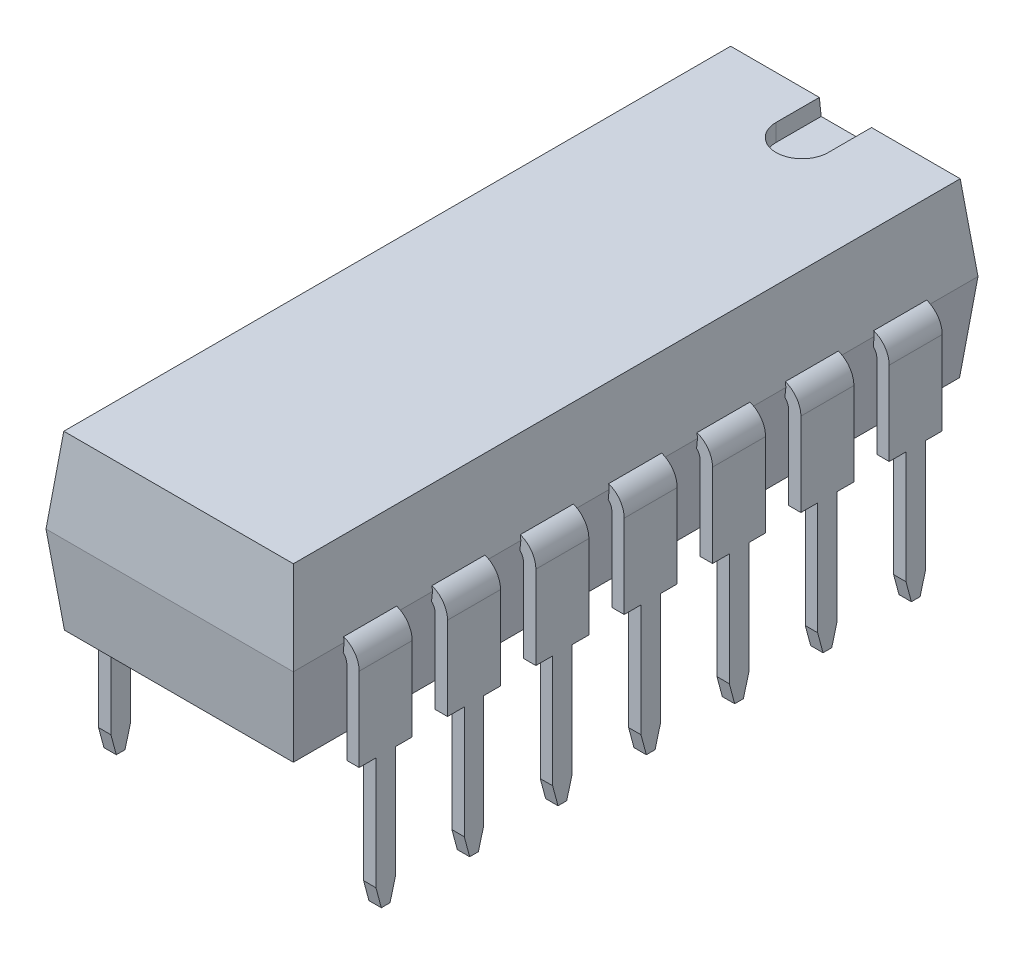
SolidWorks part; units mm, degrees
ref_plane "Front" through (0, 0, 0) normal (0, 0, 1) x (1, 0, 0)
ref_plane "Top" through (0, 0, 0) normal (0, 1, 0) x (1, 0, 0)
ref_plane "Right" through (0, 0, 0) normal (1, 0, 0) x (0, 0, -1)
ref_plane "Pin1" through (0, 0, -7.62) normal (0, 0, 1) x (1, 0, 0)
sketch "Эскиз10" plane through (0, 0, -7.62) normal (0, 0, 1) x (1, 0, 0)
  line L21 (-3.81, -3.81) -> (-3.81, 2.4) construction
  line L22 (-3.31, 2.9) -> (3.31, 2.9) construction
  line L23 (0, 2.9) -> (0, -3.81) construction
  line L24 (3.81, -3.81) -> (3.81, 2.4) construction
  line L25 (-3.6322, -3.81) -> (-3.6322, 2.4)
  line L26 (-3.31, 2.7222) -> (3.31, 2.7222)
  line L27 (3.6322, -3.81) -> (3.6322, 2.4)
  line L28 (-3.9878, -3.81) -> (-3.9878, 2.4)
  line L29 (-3.31, 3.0778) -> (3.31, 3.0778)
  line L30 (3.9878, -3.81) -> (3.9878, 2.4)
  line L31 (-3.9878, -3.81) -> (-3.6322, -3.81)
  line L32 (3.6322, -3.81) -> (3.9878, -3.81)
  arc A8 (-3.81, 2.4) -> (-3.31, 2.9) centre (-3.31, 2.4) cw construction
  arc A9 (3.81, 2.4) -> (3.31, 2.9) centre (3.31, 2.4) ccw construction
  arc A10 (-3.6322, 2.4) -> (-3.31, 2.7222) centre (-3.31, 2.4) cw
  arc A11 (3.6322, 2.4) -> (3.31, 2.7222) centre (3.31, 2.4) ccw
  arc A12 (-3.9878, 2.4) -> (-3.31, 3.0778) centre (-3.31, 2.4) cw
  arc A13 (3.9878, 2.4) -> (3.31, 3.0778) centre (3.31, 2.4) ccw
  dimension "D2" = 3.81
  dimension "D5" = 0.5
  dimension "D1" = 2.9
  dimension "eA" = 7.62
  dimension "c" = 0.3556
extrude "Вытянуть1" add sketch "Эскиз10" along normal mid plane 1.524
sketch "Эскиз11" plane through (3.9878, 0, 0) normal (1, 0, 0) x (0, 0, -1)
  line L0 (6.858, 0) -> (7.3406, 0)
  line L1 (6.858, -3.81) -> (6.858, 2.4) construction
  line L2 (7.3406, 0) -> (7.3406, -3.2338)
  line L3 (6.858, -3.81) -> (8.382, -3.81) construction
  line L4 (7.495, -3.81) -> (6.858, -3.81)
  line L5 (6.858, -3.81) -> (6.858, 0)
  line L6 (7.62, 0) -> (7.62, -3.81) construction
  line L7 (8.382, -3.81) -> (8.382, 0)
  line L8 (7.745, -3.81) -> (8.382, -3.81)
  line L9 (7.8994, 0) -> (7.8994, -3.2338)
  line L10 (8.382, 0) -> (7.8994, 0)
  line L11 (7.3406, -3.2338) -> (7.495, -3.81)
  line L12 (7.8994, -3.2338) -> (7.745, -3.81)
  dimension "D1" = 75
  dimension "b" = 0.5588
  dimension "D2" = 0.25
extrude "Вырез-Вытянуть1" cut sketch "Эскиз11" against normal through all
ref_plane "MidOfHeight" through (0, 2.9, 0) normal (0, 1, 0) x (-1, 0, 0)
sketch "Эскиз1" plane through (0, 2.9, 0) normal (0, 1, 0) x (1, 0, 0)
  line L0 (0, 9.8425) -> (0, -9.8425) construction
  line L1 (-3.556, -9.8425) -> (3.556, -9.8425)
  line L2 (-3.556, -9.8425) -> (-3.556, 9.8425)
  line L3 (-3.556, 9.8425) -> (3.556, 9.8425)
  line L4 (3.556, -9.8425) -> (3.556, 9.8425)
  line L6 (-3.31, 6.858) -> (-3.31, 8.382) construction
  line L7 (3.31, 6.858) -> (3.31, 8.382) construction
  dimension "D" = 19.685
  dimension "E1" = 7.112
extrude "Вытянуть2" add sketch "Эскиз1" along normal offset from surface 5.334 draft 6 and the other way offset from surface (2.519 mm away) 0.381 draft 6
sketch "Эскиз12" plane through (0, 5.334, 0) normal (0, 1, 0) x (-1, 0, 0)
  line L0 (0.75, -9.8425) -> (0.75, -8.3425)
  line L2 (-0.75, -8.3425) -> (-0.75, -9.8425)
  line L3 (-0.75, -9.8425) -> (0.75, -9.8425)
  line L4 (0, -8.3425) -> (0, -9.8425) construction
  arc A0 (0.75, -8.3425) -> (-0.75, -8.3425) centre (0, -8.3425) ccw
  dimension "D1" = 1.5
  dimension "D2" = 1.5
extrude "Вырез-Вытянуть2" cut sketch "Эскиз12" against normal blind 0.5
pattern_linear "Линейный массив1" count 7 spacing 2.54 along (0, 0, 1) of "Вырез-Вытянуть1", "Вытянуть1"
sketch "Эскиз13" plane through (0, 0, 0) normal (0, 0, 1) x (1, 0, 0)
  line L4 (3.3002, 5.334) -> (3.556, 2.9)
  line L5 (3.2912, 0.381) -> (3.556, 2.9)
  line L6 (-3.2912, 0.381) -> (-3.556, 2.9)
  line L7 (-3.3002, 5.334) -> (-3.556, 2.9)
  line L8 (3.2912, 0.381) -> (-3.2912, 0.381)
  line L9 (-3.3002, 5.334) -> (3.3002, 5.334)
extrude "CentralPinCut" [suppressed] cut sketch "Эскиз13" against normal mid plane 10.16 flip side to cut
sketch "Эскиз14" plane through (0, 0, 0) normal (1, 0, 0) x (0, 0, -1)
  line L0 (-9.5867, 5.334) -> (9.5867, 5.334)
  line L1 (9.5777, 0.381) -> (-9.5777, 0.381)
  line L2 (-9.5777, 0.381) -> (-9.8425, 2.9)
  line L3 (-9.8425, 2.9) -> (-9.5867, 5.334)
  line L8 (9.5867, 5.334) -> (9.8425, 2.9)
  line L9 (9.8425, 2.9) -> (9.5777, 0.381)
extrude "Cut_Pin" [suppressed] cut sketch "Эскиз14" along normal up to surface and the other way up to surface flip side to cut
ref_plane "B_Cut_PinFirst" through (0, 0, -7.8994) normal (0, 0, 1) x (1, 0, 0)
sketch "Эскиз15" plane through (0, 0, -7.8994) normal (0, 0, 1) x (1, 0, 0)
  line L6 (3.556, 2.9) -> (3.3002, 5.334)
  line L7 (3.2912, 0.381) -> (3.556, 2.9)
  line L8 (-3.2912, 0.381) -> (3.2912, 0.381)
  line L9 (-3.556, 2.9) -> (-3.2912, 0.381)
  line L10 (-3.3002, 5.334) -> (-3.556, 2.9)
  line L11 (3.3002, 5.334) -> (-3.3002, 5.334)
  line L12 (3.556, 2.9) -> (3.3002, 5.334)
  line L13 (3.2912, 0.381) -> (3.556, 2.9)
  line L14 (-3.2912, 0.381) -> (3.2912, 0.381)
  line L15 (-3.556, 2.9) -> (-3.2912, 0.381)
  line L16 (-3.3002, 5.334) -> (-3.556, 2.9)
  line L17 (3.3002, 5.334) -> (-3.3002, 5.334)
  dimension "D1" = 0
ref_plane "B_Cut_PinLast" through (0, 0, 7.8994) normal (0, 0, 1) x (1, 0, 0)
sketch "Эскиз16" plane through (0, 0, 7.8994) normal (0, 0, 1) x (1, 0, 0)
  line L6 (3.556, 2.9) -> (3.3002, 5.334)
  line L7 (3.2912, 0.381) -> (3.556, 2.9)
  line L8 (-3.2912, 0.381) -> (3.2912, 0.381)
  line L9 (-3.556, 2.9) -> (-3.2912, 0.381)
  line L10 (-3.3002, 5.334) -> (-3.556, 2.9)
  line L11 (3.3002, 5.334) -> (-3.3002, 5.334)
  line L12 (3.556, 2.9) -> (3.3002, 5.334)
  line L13 (3.2912, 0.381) -> (3.556, 2.9)
  line L14 (-3.2912, 0.381) -> (3.2912, 0.381)
  line L15 (-3.556, 2.9) -> (-3.2912, 0.381)
  line L16 (-3.3002, 5.334) -> (-3.556, 2.9)
  line L17 (3.3002, 5.334) -> (-3.3002, 5.334)
  dimension "D1" = 0
extrude "Cut_PinFirst" [suppressed] cut sketch "Эскиз15" against normal through all flip side to cut
extrude "Cut_PinLast" [suppressed] cut sketch "Эскиз16" along normal through all flip side to cut
